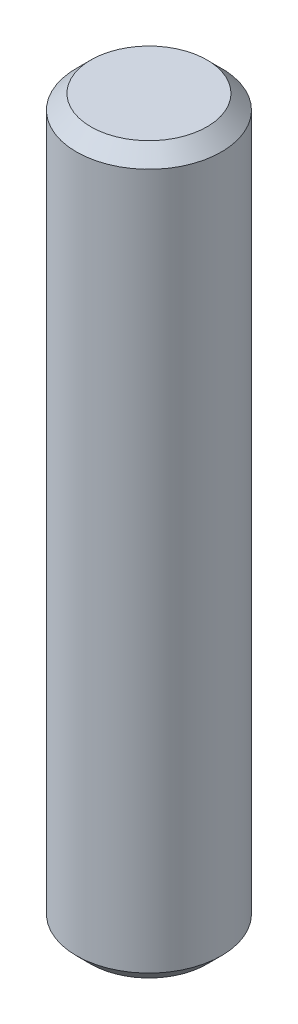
SolidWorks part; units mm, degrees
ref_plane "Front Plane" through (0, 0, 0) normal (0, 0, 1) x (1, 0, 0)
ref_plane "Top Plane" through (0, 0, 0) normal (0, 1, 0) x (1, 0, 0)
ref_plane "Right Plane" through (0, 0, 0) normal (1, 0, 0) x (0, 0, -1)
sketch "Sketch1" plane through (0, 0, 0) normal (0, 1, 0) x (1, 0, 0)
  circle A0 centre (0, 0) radius 0.5
extrude "Boss-Extrude1" add sketch "Sketch1" along normal blind 5
chamfer "Chamfer1" distance 0.1 angle 45 2 edges at (0, 0, 0.5) (0, 5, 0.5)
